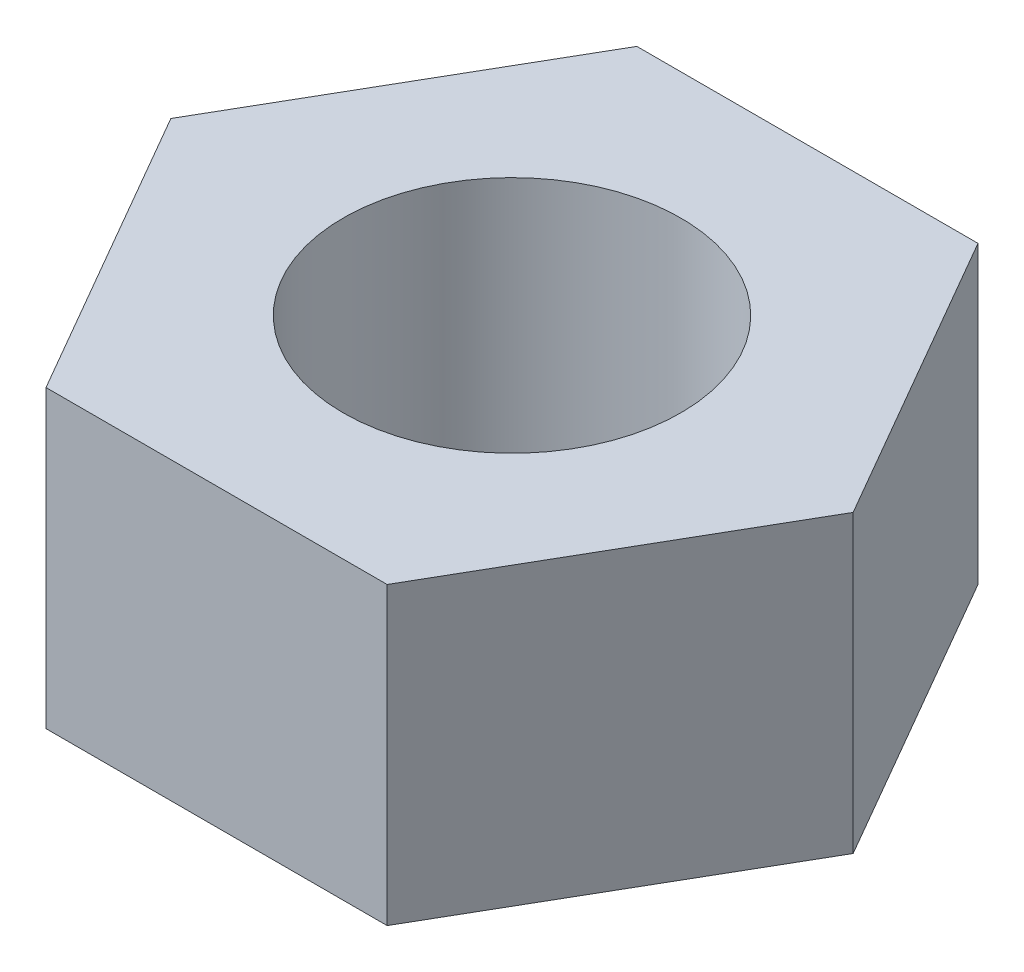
SolidWorks part; units mm, degrees
ref_plane "Front Plane" through (0, 0, 0) normal (0, 0, 1) x (1, 0, 0)
ref_plane "Top Plane" through (0, 0, 0) normal (0, 1, 0) x (1, 0, 0)
ref_plane "Right Plane" through (0, 0, 0) normal (1, 0, 0) x (0, 0, -1)
sketch "Sketch1" plane through (0, 0, 0) normal (0, 1, 0) x (1, 0, 0)
  line L1 (6.4158, 0) -> (3.2079, 5.5563)
  line L2 (3.2079, 5.5563) -> (-3.2079, 5.5563)
  line L3 (-3.2079, 5.5563) -> (-6.4158, 0)
  line L4 (-6.4158, 0) -> (-3.2079, -5.5563)
  line L5 (-3.2079, -5.5563) -> (3.2079, -5.5563)
  line L6 (3.2079, -5.5563) -> (6.4158, 0)
  circle A0 centre (0, 0) radius 3.175
  circle A1 centre (0, 0) radius 5.5562 construction
  dimension "D1" = 6.35
  dimension "D2" = 11.1125
extrude "Boss-Extrude1" add sketch "Sketch1" along normal mid plane 5.5562
